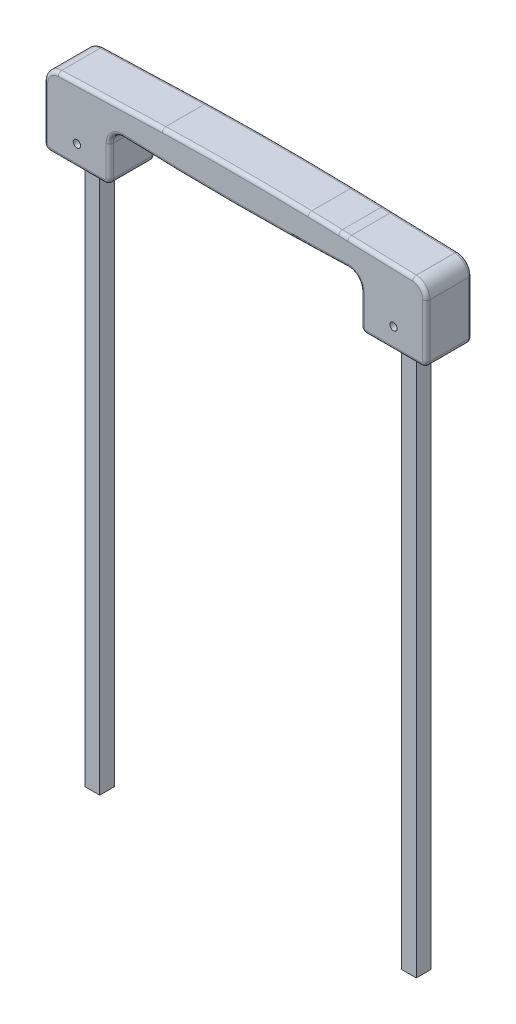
SolidWorks part; units mm, degrees
ref_plane "Alzado" through (0, 0, 0) normal (0, 0, 1) x (1, 0, 0)
ref_plane "Planta" through (0, 0, 0) normal (0, 1, 0) x (1, 0, 0)
ref_plane "Vista lateral" through (0, 0, 0) normal (1, 0, 0) x (0, 0, -1)
sketch "Croquis1" plane through (0, 0, 0) normal (0, 0, 1) x (1, 0, 0)
  line L0 (-86.755, 0) -> (86.755, 0) construction
  line L1 (-104.755, 0) -> (-68.755, 0)
  line L2 (-104.755, 0) -> (-104.755, -8.4131)
  line L3 (-101.755, -11.4131) -> (-71.755, -11.4131)
  line L5 (-104.755, -8.4131) -> (-104.755, 20.7548)
  line L6 (-68.755, -8.4131) -> (-68.755, 8.2041)
  line L7 (0, 30.8751) -> (0, -37.132) construction
  line L8 (40, 30.5618) -> (97.009, 28.7508)
  line L10 (104.755, -8.4131) -> (104.755, 20.7548)
  line L11 (68.755, -8.4131) -> (68.755, 8.2041)
  line L12 (101.755, -11.4131) -> (71.755, -11.4131)
  line L13 (104.755, 0) -> (104.755, -8.4131)
  line L14 (104.755, 0) -> (68.755, 0)
  line L15 (86.755, -11.4131) -> (86.755, 29.0765) construction
  line L16 (61.755, 15.2041) -> (61.755, 29.8351) construction
  line L17 (61.755, 29.8351) -> (97.3219, 28.7347)
  line L19 (-97.009, 28.7508) -> (-40, 30.5618)
  line L20 (-40, 30.5618) -> (-97.009, 28.7508)
  line L27 (-86.755, -11.4131) -> (-86.755, 29.0766) construction
  circle A0 centre (-86.755, 0) radius 2
  circle A1 centre (86.755, 0) radius 2
  arc A2 (-104.755, -8.4131) -> (-101.755, -11.4131) centre (-101.755, -8.4131) ccw
  arc A3 (-71.755, -11.4131) -> (-68.755, -8.4131) centre (-71.755, -8.4131) ccw
  arc A5 (-61.755, 15.2041) -> (-68.755, 8.2041) centre (-61.755, 8.2041) ccw
  arc A6 (61.755, 15.2041) -> (68.755, 8.2041) centre (61.755, 8.2041) cw
  arc A8 (71.755, -11.4131) -> (68.755, -8.4131) centre (71.755, -8.4131) cw
  arc A9 (104.755, -8.4131) -> (101.755, -11.4131) centre (101.755, -8.4131) cw
  arc A11 (-61.755, 15.2041) -> (61.755, 15.2041) centre (0, 1536.3115) ccw
  arc A12 (-56.7764, 30.0289) -> (61.755, 29.8351) centre (-0.0011, -1492.8636) cw
  arc A13 (-104.755, 20.7548) -> (-97.009, 28.7508) centre (-96.755, 20.7548) cw
  arc A14 (104.755, 20.7548) -> (97.009, 28.7508) centre (96.755, 20.7548) ccw
  point P15 (-68.755, -11.4131)
  point P23 (-68.755, 13.5869)
  point P38 (0, 16.451)
  point P40 (68.755, 13.5869)
  point P41 (68.755, -11.4131)
  point P44 (40, 30.5618)
  point P46 (2.4912, 31.0848)
  point P47 (0, 13.951)
  point P50 (0, 22.3225)
  point P52 (-40, 30.5618)
  dimension "D2" = 4
  dimension "D3" = 4
  dimension "D4" = 3
  dimension "D5" = 3
  dimension "D9" = 7
  dimension "D10" = 2.5
  dimension "D13" = 8
  dimension "D14" = 8
  dimension "D6" = 173.51
  dimension "D8" = 25
  dimension "D11" = 2.5
  dimension "D12" = 30
extrude "Saliente-Extruir2" add sketch "Croquis1" along normal blind 25 contours L10 A14 L17 A12 L8 L20 L19 A13 L5 L1 A0 L6 A5 A11 A6 L11 L14 A1 | L3 A3 L6 L1 A0 L2 A2 | A9 L10 L14 A1 L11 A8 L12
fillet "Redondeo1" radius 2 26 edges at (-66.7047, 13.1538, 0) (-68.755, -0.1045, 0) (-69.6337, -10.5344, 0) (-86.755, -11.4131, 0) (-103.8763, -10.5344, 0) (-104.755, 6.1709, 0) (-102.501, 26.3212, 0) (-68.5045, 29.6563, 0) (79.5384, 29.2849, 0) (59.2622, 29.9341, 0) (48.3846, 30.2954, 0) (-66.7047, 13.1538, 25) (-68.755, -0.1045, 25) (-69.6337, -10.5344, 25) (-86.755, -11.4131, 25) (-103.8763, -10.5344, 25) (-104.755, 6.1709, 25) (-102.501, 26.3212, 25) (79.5384, 29.2849, 25) (59.2622, 29.9341, 25) (48.3846, 30.2954, 25) (40, 30.5618, 12.5) (0, 31.0869, 0) (0, 31.0869, 25) (-40, 30.5618, 12.5) (-68.5045, 29.6563, 25)
fillet "Redondeo3" radius 2 18 edges at (66.7047, 13.1538, 0) (66.7047, 13.1538, 25) (68.755, -0.1045, 0) (68.755, -0.1045, 25) (69.6337, -10.5344, 0) (69.6337, -10.5344, 25) (86.755, -11.4131, 0) (86.755, -11.4131, 25) (103.8763, -10.5344, 0) (103.8763, -10.5344, 25) (104.755, 6.1709, 0) (104.755, 6.1709, 25) (104.0984, 23.9288, 25) (97.496, 28.7204, 23.1884) (97.3219, 28.7347, 12.5) (97.7177, 28.6967, 1.68) (104.0984, 23.9288, 0) (-2.6842, 13.9534, 25)
sketch "Croquis2" plane through (0, -11.4131, 0) normal (0, -1, 0) x (1, 0, 0)
  line L0 (-86.755, 2) -> (-86.755, 23) construction
  line L1 (-101.755, 2) -> (-71.755, 2) construction
  line L2 (-71.755, 23) -> (-101.755, 23) construction
  line L4 (-90.755, 16.5) -> (-82.755, 16.5)
  line L5 (-90.755, 16.5) -> (-90.755, 8.5)
  line L6 (-90.755, 8.5) -> (-82.755, 8.5)
  line L7 (-82.755, 16.5) -> (-82.755, 8.5)
  line L8 (-90.755, 16.5) -> (-82.755, 8.5) construction
  line L9 (-90.755, 8.5) -> (-82.755, 16.5) construction
  point P6 (-86.755, 12.5)
  dimension "D1" = 8
  dimension "D2" = 8
extrude "Cortar-Extruir1" cut sketch "Croquis2" against normal blind 25
sketch "Croquis3" plane through (0, -11.4131, 0) normal (0, -1, 0) x (1, 0, 0)
  line L0 (86.755, 23) -> (86.755, 2) construction
  line L1 (101.755, 23) -> (71.755, 23) construction
  line L2 (71.755, 2) -> (101.755, 2) construction
  line L4 (82.755, 16.5) -> (90.755, 16.5)
  line L5 (82.755, 16.5) -> (82.755, 8.5)
  line L6 (82.755, 8.5) -> (90.755, 8.5)
  line L7 (90.755, 16.5) -> (90.755, 8.5)
  line L8 (82.755, 16.5) -> (90.755, 8.5) construction
  line L9 (82.755, 8.5) -> (90.755, 16.5) construction
  point P6 (86.755, 12.5)
  dimension "D1" = 8
  dimension "D2" = 8
extrude "Cortar-Extruir2" cut sketch "Croquis3" against normal blind 25
sketch "Croquis4" plane through (0, 13.5869, 0) normal (0, -1, 0) x (1, 0, 0)
  line L0 (86.755, 8.5) -> (86.755, 16.5) construction
  line L1 (82.755, 8.5) -> (90.755, 8.5) construction
  line L2 (90.755, 16.5) -> (82.755, 16.5) construction
  line L4 (90.755, 8.5) -> (82.755, 8.5)
  line L5 (90.755, 8.5) -> (90.755, 16.5)
  line L6 (90.755, 16.5) -> (82.755, 16.5)
  line L7 (82.755, 8.5) -> (82.755, 16.5)
  line L8 (90.755, 8.5) -> (82.755, 16.5) construction
  line L9 (90.755, 16.5) -> (82.755, 8.5) construction
  point P6 (86.755, 12.5)
extrude "Saliente-Extruir4" add sketch "Croquis4" along normal blind 325
sketch "Croquis6" plane through (0, 13.5869, 0) normal (0, -1, 0) x (1, 0, 0)
  line L0 (-86.755, 8.5) -> (-86.755, 16.5) construction
  line L1 (-90.755, 8.5) -> (-82.755, 8.5) construction
  line L2 (-82.755, 16.5) -> (-90.755, 16.5) construction
  line L4 (-82.755, 8.5) -> (-90.755, 8.5)
  line L5 (-82.755, 8.5) -> (-82.755, 16.5)
  line L6 (-82.755, 16.5) -> (-90.755, 16.5)
  line L7 (-90.755, 8.5) -> (-90.755, 16.5)
  line L8 (-82.755, 8.5) -> (-90.755, 16.5) construction
  line L9 (-82.755, 16.5) -> (-90.755, 8.5) construction
  point P6 (-86.755, 12.5)
extrude "Saliente-Extruir5" add sketch "Croquis6" along normal blind 325
